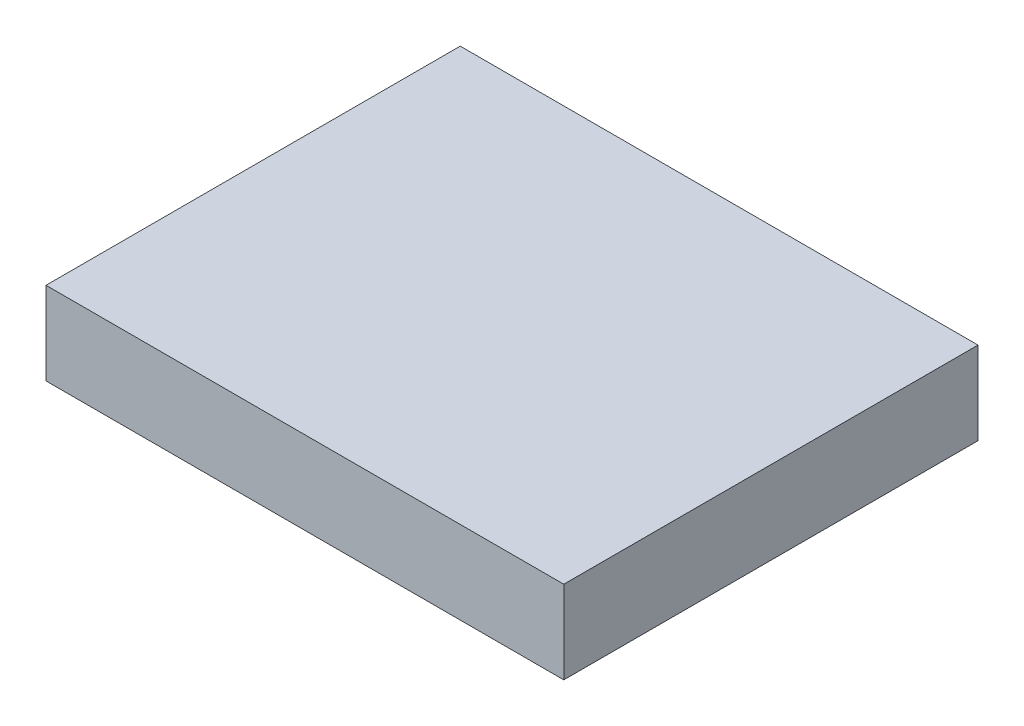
SolidWorks part; units mm, degrees
ref_plane "Plan de face" through (0, 0, 0) normal (0, 0, 1) x (1, 0, 0)
ref_plane "Plan de dessus" through (0, 0, 0) normal (0, 1, 0) x (1, 0, 0)
ref_plane "Plan de droite" through (0, 0, 0) normal (1, 0, 0) x (0, 0, -1)
sketch "Esquisse1" plane through (0, 0, 0) normal (0, 1, 0) x (1, 0, 0)
  line L1 (0, 0) -> (50, 0)
  line L2 (0, 0) -> (0, 40)
  line L3 (0, 40) -> (50, 40)
  line L4 (50, 0) -> (50, 40)
  dimension "D1" = 50
  dimension "D2" = 40
extrude "Extrusion1" add sketch "Esquisse1" along normal blind 8
